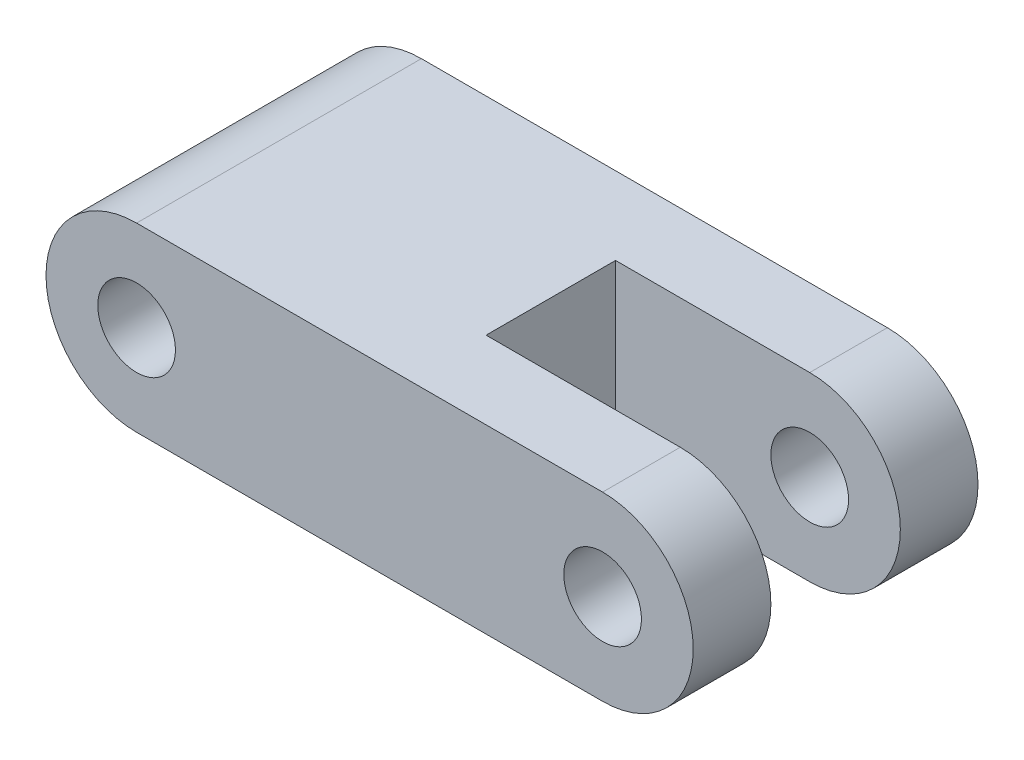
SolidWorks part; units mm, degrees
ref_plane "Plan1" through (0, 0, 0) normal (0, 0, 1) x (1, 0, 0)
ref_plane "Plan2" through (0, 0, 0) normal (0, 1, 0) x (1, 0, 0)
ref_plane "Plan3" through (0, 0, 0) normal (1, 0, 0) x (0, 0, -1)
sketch "Esquisse1" plane through (0, 0, 0) normal (0, 0, 1) x (1, 0, 0)
  line L0 (0, 0) -> (36, 0) construction
  line L2 (0, 7) -> (36, 7)
  line L4 (0, -7) -> (36, -7)
  arc A0 (0, 7) -> (0, -7) centre (0, 0) ccw
  arc A1 (36, -7) -> (36, 7) centre (36, 0) ccw
  dimension "D2" = 14
  dimension "D7" = 36
extrude "BASE" add sketch "Esquisse1" along normal mid plane 22
hole_wizard "PASSAGE AXE" positions "Esquisse3" profile "Esquisse2" hole size "M6.0" standard "ISO"
sketch "Esquisse3" plane through (0, 0, 11) normal (0, 0, 1) x (1, 0, 0)
  line L0 (0, 0) -> (36, 0) construction
  point P0 (36, 0)
  point P1 (0, 0)
  dimension "D1" = 36
sketch "Esquisse2" plane through (36, 0, 11) normal (1, 0, 0) x (0, -1, 0)
  line L0 (0, 0) -> (0, 22)
  line L1 (0, 22) -> (3, 22)
  line L2 (3, 22) -> (3, 0)
  line L5 (3, 0) -> (0, 0)
  line L11 (0, -6.35) -> (0, 107.95) construction
  dimension "Diamètre du perçage jusqu'au prochain" = 6
  dimension "Profondeur du perçage jusqu'au prochain" = 22
sketch "Esquisse4" plane through (0, 7, 0) normal (0, 1, 0) x (-1, 0, 0)
  line L0 (0, 0) -> (-49, 0) construction
  line L1 (-43, -5) -> (-21, -5)
  line L2 (-43, -5) -> (-43, 5)
  line L3 (-43, 5) -> (-21, 5)
  line L4 (-21, -5) -> (-21, 5)
  line L6 (-36, -11) -> (-36, 11) construction
  line L7 (-43, 11) -> (-43, -11) construction
  dimension "D1" = 15
  dimension "D2" = 10
extrude "Enlèv. mat.-Extru.1" cut sketch "Esquisse4" against normal through all
